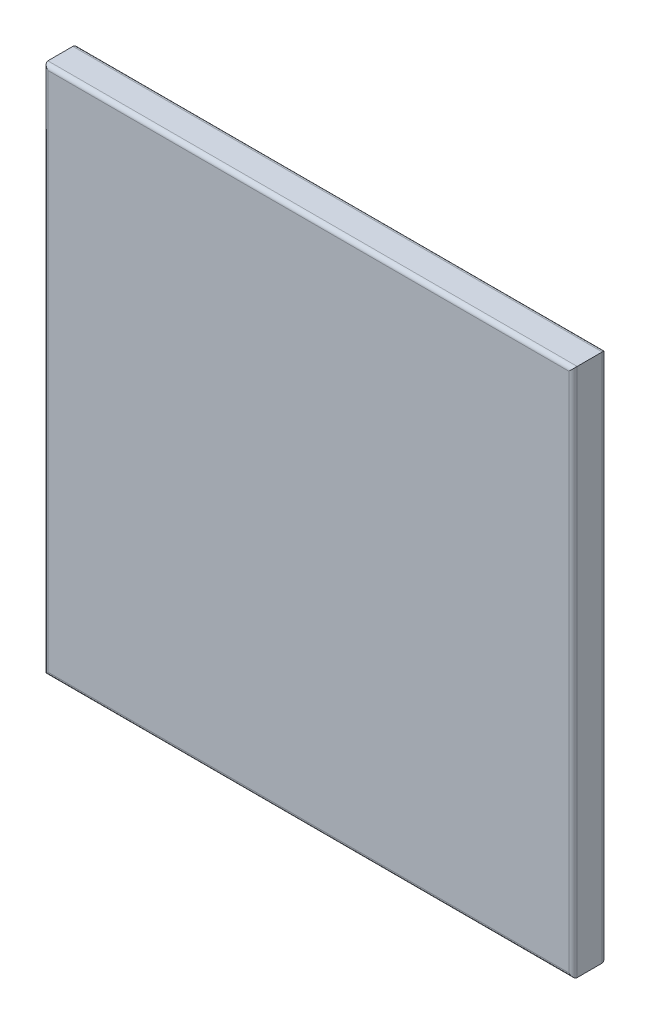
SolidWorks part; units mm, degrees
ref_plane "Ebene vorne" through (0, 0, 0) normal (0, 0, 1) x (1, 0, 0)
ref_plane "Ebene oben" through (0, 0, 0) normal (0, 1, 0) x (1, 0, 0)
ref_plane "Ebene rechts" through (0, 0, 0) normal (1, 0, 0) x (0, 0, -1)
sketch "Skizze1" plane through (0, 0, 0) normal (0, 0, 1) x (1, 0, 0)
  line L1 (-15.9, -15.9) -> (15.9, -15.9)
  line L2 (-15.9, -15.9) -> (-15.9, 15.9)
  line L3 (-15.9, 15.9) -> (15.9, 15.9)
  line L4 (15.9, -15.9) -> (15.9, 15.9)
  line L5 (-15.9, -15.9) -> (15.9, 15.9) construction
  line L6 (-15.9, 15.9) -> (15.9, -15.9) construction
  point P0 (0, 0)
  dimension "D1" = 31.8
extrude "Aufsatz-Linear austragen1" add sketch "Skizze1" along normal blind 2
fillet "Verrundung1" radius 0.25 8 edges at (0, 15.9, 0) (-15.9, 0, 0) (0, -15.9, 0) (15.9, 0, 0) (0, -15.9, 2) (-15.9, 0, 2) (0, 15.9, 2) (15.9, 0, 2)
